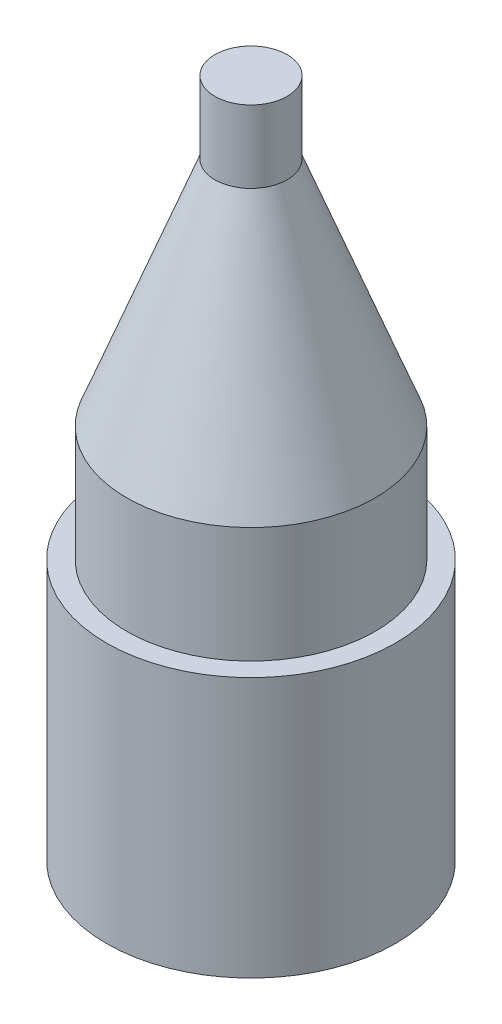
SolidWorks part; units mm, degrees
ref_plane "Front Plane" through (0, 0, 0) normal (0, 0, 1) x (1, 0, 0)
ref_plane "Top Plane" through (0, 0, 0) normal (0, 1, 0) x (1, 0, 0)
ref_plane "Right Plane" through (0, 0, 0) normal (1, 0, 0) x (0, 0, -1)
sketch "Sketch1" plane through (0, 0, 0) normal (0, 1, 0) x (1, 0, 0)
  circle A0 centre (0, 0) radius 12.7
  dimension "D1" = 25.4
extrude "Extrude1" add sketch "Sketch1" along normal blind 22.86
sketch "Sketch2" plane through (0, 0, 0) normal (0, 0, 1) x (1, 0, 0)
  line L0 (0, 0) -> (0, 61.9324) construction
  line L1 (-10.922, 22.86) -> (-10.922, 33.02)
  line L2 (-3.175, 53.34) -> (-3.175, 59.69)
  line L3 (-3.175, 59.69) -> (0, 59.69)
  line L4 (0, 59.69) -> (0, 22.86)
  line L5 (12.7, 22.86) -> (-12.7, 22.86) construction
  line L6 (-10.922, 33.02) -> (-3.175, 53.34)
  line L7 (0, 22.86) -> (-10.922, 22.86)
  dimension "D1" = 3.175
  dimension "D2" = 10.922
  dimension "D3" = 20.32
  dimension "D4" = 10.16
  dimension "D5" = 6.35
  dimension "D6" = 2.2424
revolve "Revolve1" add sketch "Sketch2" angle 360 about L0
